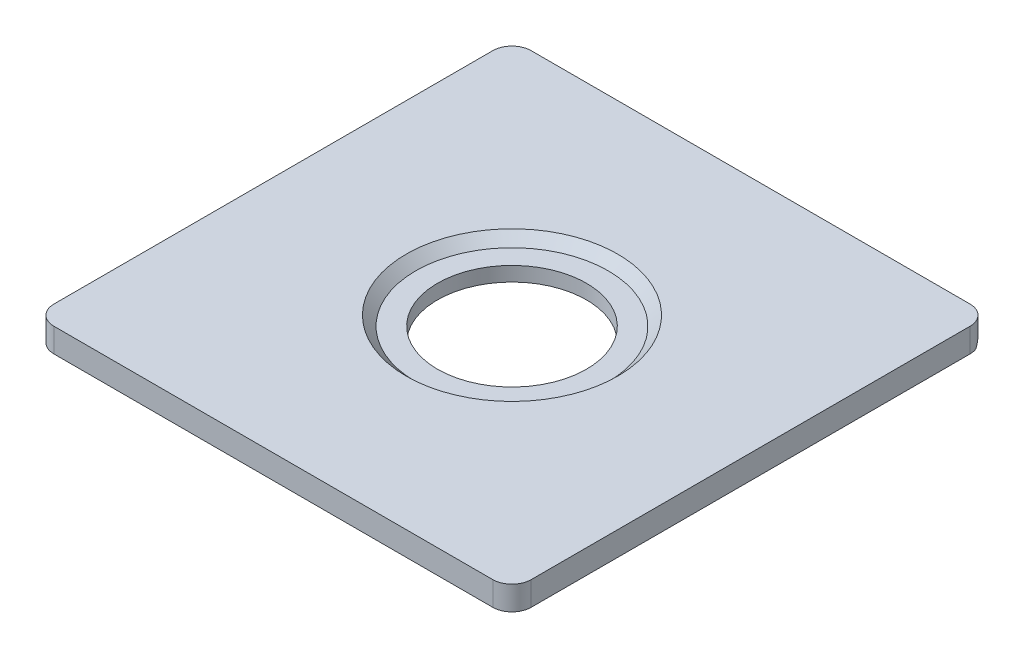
SolidWorks part; units mm, degrees
ref_plane "Front Plane" through (0, 0, 0) normal (0, 0, 1) x (1, 0, 0)
ref_plane "Top Plane" through (0, 0, 0) normal (0, 1, 0) x (1, 0, 0)
ref_plane "Right Plane" through (0, 0, 0) normal (1, 0, 0) x (0, 0, -1)
sketch "Sketch1" plane through (0, 0, 0) normal (0, 1, 0) x (1, 0, 0)
  line L1 (-49.65, 49.65) -> (49.65, 49.65)
  line L2 (-49.65, 49.65) -> (-49.65, -49.65)
  line L3 (-49.65, -49.65) -> (49.65, -49.65)
  line L4 (49.65, 49.65) -> (49.65, -49.65)
  line L5 (-49.65, 49.65) -> (49.65, -49.65) construction
  line L6 (-49.65, -49.65) -> (49.65, 49.65) construction
  circle A0 centre (0, 0) radius 15.5
  point P0 (0, 0)
  dimension "D3" = 31
  dimension "D1" = 99.3
  dimension "D2" = 99.3
extrude "Boss-Extrude1" add sketch "Sketch1" along normal mid plane 5
sketch "Croquis1" plane through (0, 2.5, 0) normal (0, 1, 0) x (1, 0, 0)
  circle A0 centre (0, 0) radius 20
  dimension "D1" = 40
extrude "Cortar-Extruir1" cut sketch "Croquis1" against normal blind 2
chamfer "Chaflán1" distance 2 angle 45 1 edges at (0, 2.5, 20)
chamfer "Chaflán2" distance 2.5 angle 45 1 edges at (0, -2.5, -49.65)
fillet "Fillet1" radius 4 4 edges at (-49.65, 1.25, -49.65) (49.65, 1.25, -49.65) (49.65, 0, 49.65) (-49.65, 0, 49.65)
